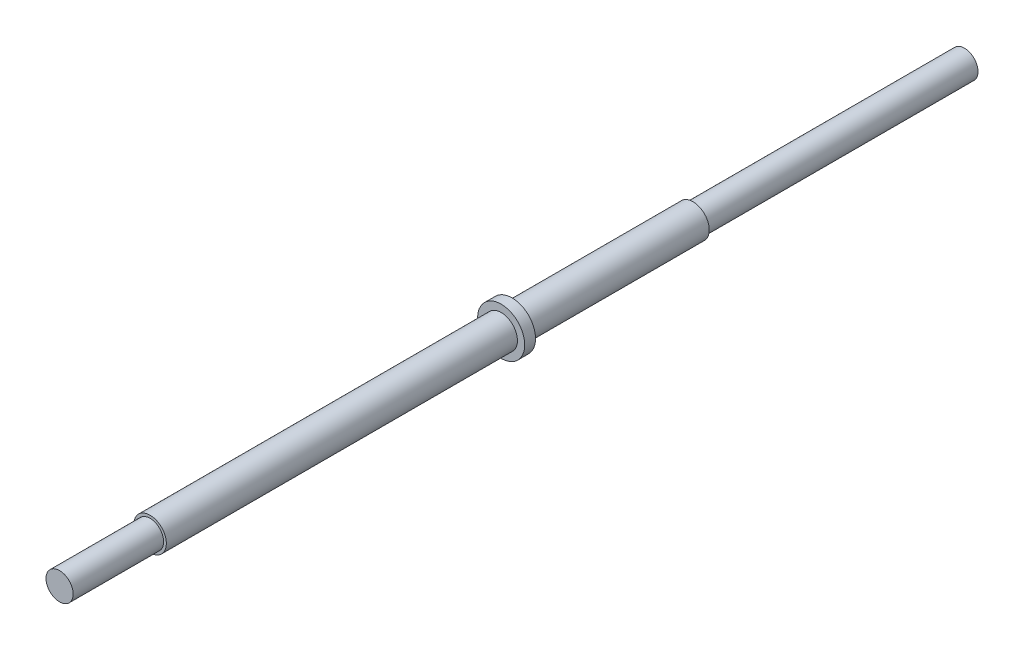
SolidWorks part; units mm, degrees
ref_plane "Front Plane" through (0, 0, 0) normal (0, 0, 1) x (1, 0, 0)
ref_plane "Top Plane" through (0, 0, 0) normal (0, 1, 0) x (1, 0, 0)
ref_plane "Right Plane" through (0, 0, 0) normal (1, 0, 0) x (0, 0, -1)
sketch "Sketch1" plane through (0, 0, 0) normal (0, 0, 1) x (1, 0, 0)
  circle A0 centre (0, 0) radius 4.5
  dimension "D1" = 9
extrude "Boss-Extrude1" add sketch "Sketch1" along normal blind 250
sketch "Sketch5" plane through (0, 0, 0) normal (0, 1, 0) x (1, 0, 0)
  line L0 (4.5, 0) -> (4.5, -75)
  line L1 (4.5, 0) -> (-4.5, 0) construction
  line L2 (4.5, -75) -> (3.75, -75)
  line L3 (3.75, -75) -> (3.75, 0)
  line L4 (3.75, 0) -> (4.5, 0)
  line L5 (0, 0) -> (0, -249.9125) construction
  point P9 (0, 0)
  dimension "D1" = 75
  dimension "D2" = 0.75
revolve "Cut-Revolve1" cut sketch "Sketch5" angle 360 about L5
ref_plane "Plane1" through (0, 0, 125) normal (0, 0, 1) x (1, 0, 0)
sketch "Sketch7" plane through (0, 0, 0) normal (0, 1, 0) x (1, 0, 0)
  line L0 (3.75, 0) -> (2.85, -0.3588)
  line L1 (2.85, -0.3588) -> (3.75, -0.6509)
  line L2 (3.75, -75) -> (3.75, 0) construction
  line L3 (3.75, -0.6509) -> (3.75, 0)
  dimension "D1" = 0.9
sketch "Sketch13" plane through (0, 0, 0) normal (1, 0, 0) x (0, 0, -1)
  line L0 (-125, 4.5005) -> (-125, 6.5005)
  line L1 (-125, 6.5005) -> (-128, 6.5005)
  line L2 (-128, 6.5005) -> (-128, 4.5005)
  line L3 (-128, 4.5005) -> (-125, 4.5005)
  line L4 (-75, -4.5) -> (-75, 4.5) construction
  line L5 (0, 0) -> (-249.9755, 0) construction
  dimension "D1" = 50
  dimension "D2" = 2
  dimension "D3" = 3
revolve "Revolve2" add sketch "Sketch13" angle 360 about L5
sketch "Sketch14" plane through (0, 0, 0) normal (0, 1, 0) x (1, 0, 0)
  line L1 (4.5, -250) -> (3.75, -250)
  line L2 (4.5, -250) -> (4.5, -225)
  line L3 (4.5, -225) -> (3.75, -225)
  line L4 (3.75, -250) -> (3.75, -225)
  dimension "D1" = 25
  dimension "D2" = 0.75
revolve "Cut-Revolve2" cut sketch "Sketch14" angle 360 about L5
